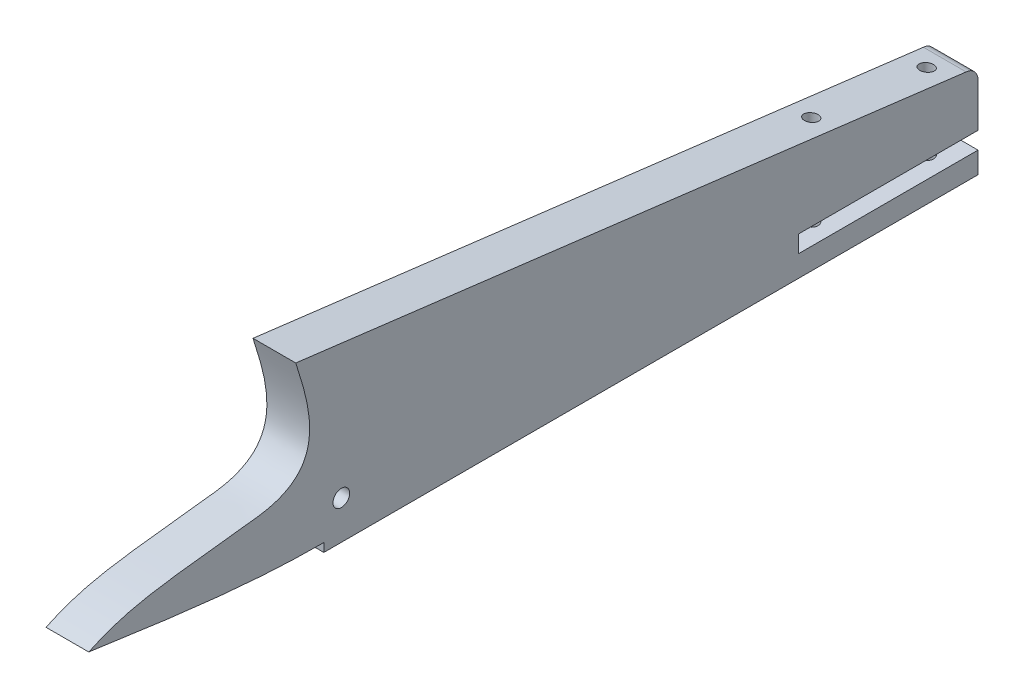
SolidWorks part; units mm, degrees
ref_plane "Plan de face" through (0, 0, 0) normal (0, 0, 1) x (1, 0, 0)
ref_plane "Plan de dessus" through (0, 0, 0) normal (0, 1, 0) x (1, 0, 0)
ref_plane "Plan de droite" through (0, 0, 0) normal (1, 0, 0) x (0, 0, -1)
sketch "Esquisse1" plane through (0, 0, 0) normal (1, 0, 0) x (0, 0, -1)
  line L0 (-79.0921, 0) -> (468.674, 0) construction
  line L10 (87.1343, -28.3155) -> (87.1343, 75.1731) construction
  line L11 (96.8159, -28.3155) -> (96.8159, 75.1731) construction
  line L12 (106.4975, -28.3155) -> (106.4975, 75.1731) construction
  line L13 (116.1791, -28.3155) -> (116.1791, 75.1731) construction
  line L14 (125.8607, -28.3155) -> (125.8607, 75.1731) construction
  line L15 (135.5423, -28.3155) -> (135.5423, 75.1731) construction
  line L16 (132.3708, 2) -> (149.2906, 2) construction
  line L26 (98.0052, 6) -> (101.3703, 6) construction
  line L27 (107.0653, 4.7) -> (111.4659, 4.7) construction
  line L28 (117.4197, 4) -> (121.432, 4) construction
  line L29 (127.1269, 3) -> (131.0098, 3) construction
  line L30 (147, 20.3151) -> (147, -36.2431) construction
  line L35 (300, 75.1731) -> (300, -12.232) construction
  line L36 (288.4597, 22) -> (369.3673, 22) construction
  line L37 (255.9351, 5) -> (323.5664, 5) construction
  line L38 (255.9351, 9) -> (323.5664, 9) construction
  line L39 (258, -12.232) -> (258, 28.6218) construction
  line L40 (297.2364, 22.2184) -> (140.4347, 41.6613)
  line L45 (300, 19.2278) -> (300, 9)
  line L46 (300, 9) -> (258, 9)
  line L47 (258, 9) -> (258, 5)
  line L48 (258, 5) -> (300, 5)
  line L49 (300, 5) -> (300, 0)
  line L50 (300, 0) -> (147, 0)
  line L51 (147, 0) -> (147, 2)
  line L73 (0, -28.3155) -> (0, 75.1731) construction
  line L74 (9.6816, -28.3155) -> (9.6816, 75.1731) construction
  line L75 (19.3632, -28.3155) -> (19.3632, 75.1731) construction
  line L76 (29.0448, -28.3155) -> (29.0448, 75.1731) construction
  line L77 (38.7264, -28.3155) -> (38.7264, 75.1731) construction
  line L78 (48.408, -28.3155) -> (48.408, 75.1731) construction
  line L79 (58.0895, -28.3155) -> (58.0895, 75.1731) construction
  line L80 (67.7711, -28.3155) -> (67.7711, 75.1731) construction
  line L81 (77.4527, -28.3155) -> (77.4527, 75.1731) construction
  circle A6 centre (151.0899, 9) radius 1.95
  arc A7 (297.2364, 22.2184) -> (300, 19.2278) centre (297, 19.2278) cw
  spline S3 degree 3 poles (92.018, 7.3294) (110.5151, 4.6974) (128.8089, 2.0096) (147, 2) knots 0.628987 0.628987 0.628987 0.628987 1 1 1 1
  spline S4 degree 3 poles (92.018, 7.3294) (101.6124, 11.7919) (108.316, 12.2812) (147.6199, 16.8226) (144.5496, 29.0416) (140.4347, 41.6613) knots 0.11584 0.11584 0.11584 0.11584 0.614992 0.614992 0.980333 0.980333 0.980333 0.980333
  dimension "D18" = 3
  dimension "D7" = 22
  dimension "D8" = 5
  dimension "D9" = 4
  dimension "D10" = 42
extrude "Extrusion1" add sketch "Esquisse1" along normal blind 10
sketch "Esquisse2" plane through (0, 0, 0) normal (0, -1, 0) x (1, 0, 0)
  line L0 (5, -303.7162) -> (5, -247.1716) construction
  line L1 (-7.1024, -300) -> (25.5042, -300) construction
  line L2 (25.5042, -293) -> (-7.1024, -293) construction
  line L3 (25.5042, -266) -> (-7.1024, -266) construction
  circle A0 centre (5, -293) radius 1.6
  circle A1 centre (5, -266) radius 1.6
  dimension "D1" = 27
  dimension "D2" = 7
extrude "Enlèv. mat.-Extru.1" cut sketch "Esquisse2" against normal blind 28
sketch "Esquisse3" plane through (0, 0, 0) normal (0, -1, 0) x (1, 0, 0)
  line L0 (5, -305.9174) -> (5, -236.386) construction
  line L1 (-7.4265, -300) -> (12.0813, -300) construction
  line L2 (-7.4265, -250) -> (10.5084, -250) construction
  line L3 (7.5, -237.7794) -> (7.5, -252.4187) construction
  line L4 (2.5, -237.7794) -> (2.5, -252.4187) construction
  line L5 (7.5, -249.5) -> (2.5, -249.5)
  line L6 (2.5, -250.5) -> (7.5, -250.5)
  arc A0 (2.5, -249.5) -> (2.5, -250.5) centre (2.5, -250) ccw
  arc A1 (7.5, -250.5) -> (7.5, -249.5) centre (7.5, -250) ccw
  dimension "D1" = 50
  dimension "D2" = 5
  dimension "D3" = 2.5
extrude "Enlèv. mat.-Extru.2" cut sketch "Esquisse3" against normal blind 8
